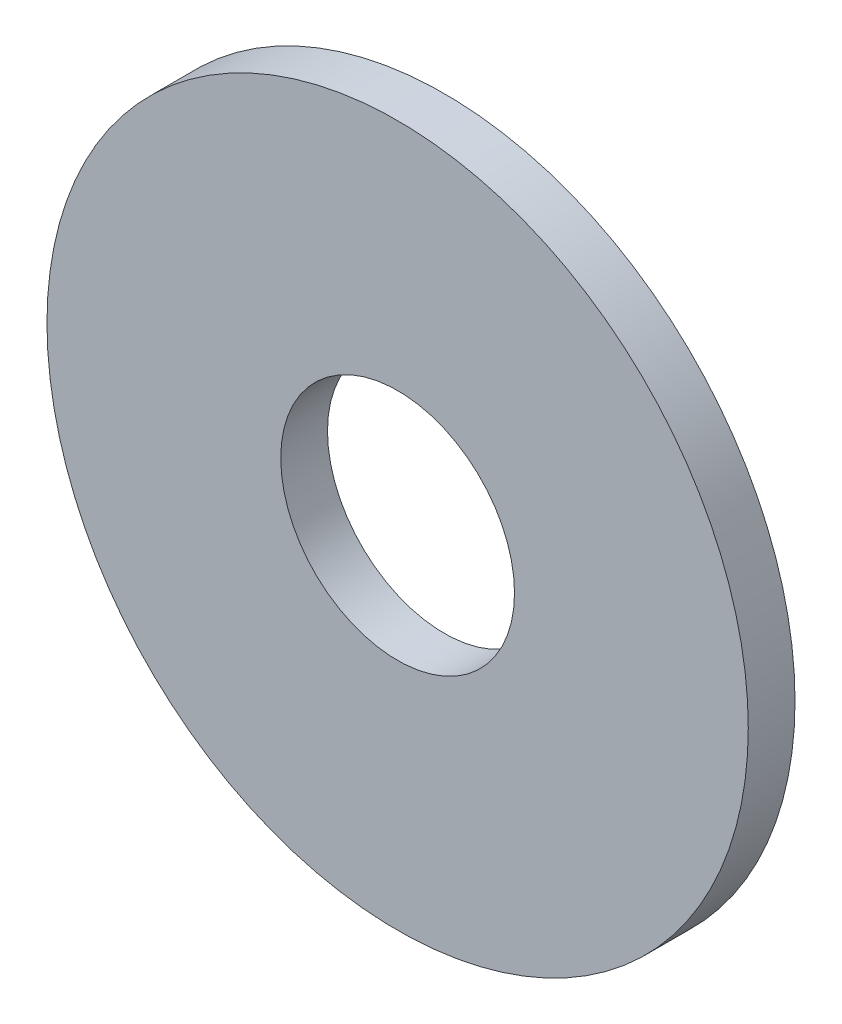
SolidWorks part; units mm, degrees
ref_plane "Plan de face" through (0, 0, 0) normal (0, 0, 1) x (1, 0, 0)
ref_plane "Plan de dessus" through (0, 0, 0) normal (0, 1, 0) x (1, 0, 0)
ref_plane "Plan de droite" through (0, 0, 0) normal (1, 0, 0) x (0, 0, -1)
sketch "Esquisse1" plane through (0, 0, 0) normal (0, 0, 1) x (1, 0, 0)
  circle A0 centre (0, 0) radius 3
  circle A1 centre (0, 0) radius 9
extrude "Extrusion1" add sketch "Esquisse1" along normal blind 1.2
